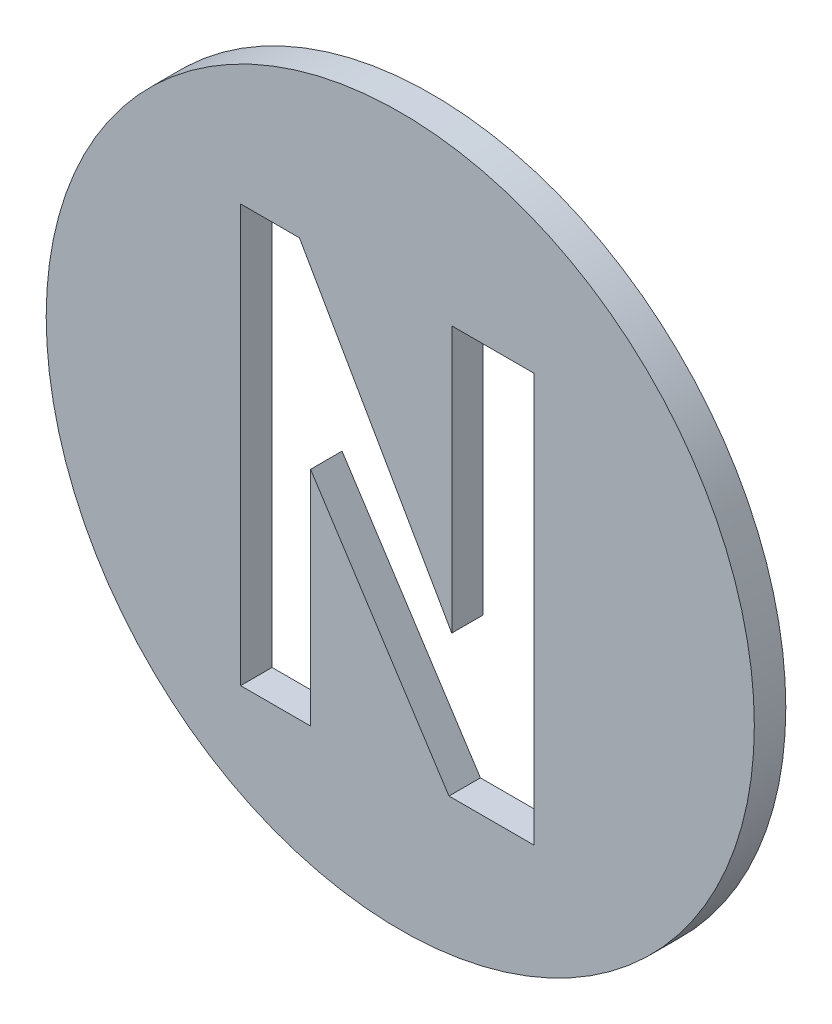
SolidWorks part; units mm, degrees
ref_plane "Front Plane" through (0, 0, 0) normal (0, 0, 1) x (1, 0, 0)
ref_plane "Top Plane" through (0, 0, 0) normal (0, 1, 0) x (1, 0, 0)
ref_plane "Right Plane" through (0, 0, 0) normal (1, 0, 0) x (0, 0, -1)
sketch "Sketch1" plane through (0, 0, 0) normal (0, 0, 1) x (1, 0, 0)
  circle A0 centre (0, 0) radius 45
  dimension "D1" = 90
extrude "Boss-Extrude1" add sketch "Sketch1" along normal blind 4
sketch "Sketch2" plane through (0, 0, 4) normal (0, 0, 1) x (1, 0, 0)
  line L0 (-20.2938, 24.7672) -> (-12.8128, 24.7672)
  line L1 (-12.8128, 24.7672) -> (6.5464, -9.0582)
  line L2 (6.5464, -9.0582) -> (6.5464, 24.7672)
  line L3 (-20.2938, -28.2586) -> (-11.3992, -28.2586)
  line L4 (-11.3992, -28.2586) -> (-11.3992, 0)
  line L5 (-11.3992, 0) -> (6.1884, -27.1675)
  line L6 (6.1884, -27.1675) -> (17.0206, -27.1675)
  line L7 (17.0206, -27.1675) -> (17.0206, 24.7672)
  line L8 (17.0206, 24.7672) -> (6.5464, 24.7672)
  line L10 (-20.2938, 24.7672) -> (-20.2938, -28.2586)
extrude "Cut-Extrude1" cut sketch "Sketch2" against normal blind 4
